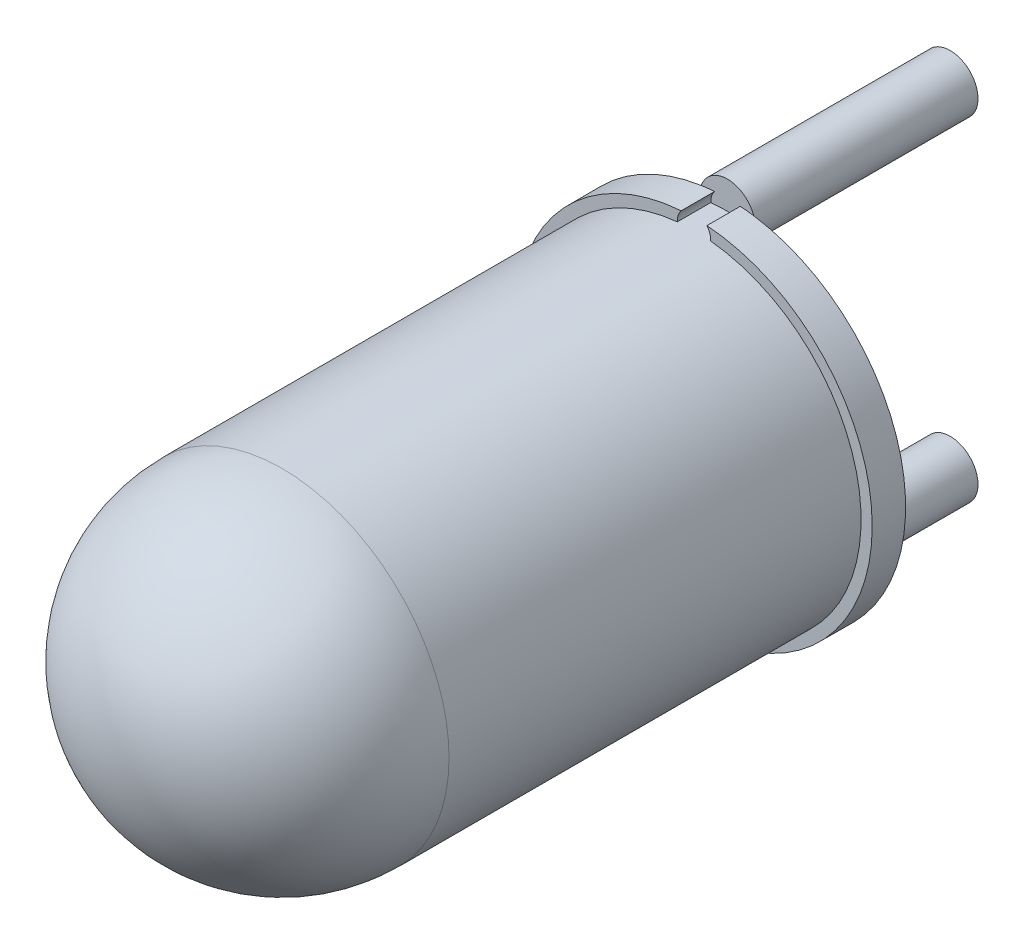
SolidWorks part; units mm, degrees
ref_plane "Front" through (0, 0, 0) normal (0, 0, 1) x (1, 0, 0)
ref_plane "Top" through (0, 0, 0) normal (0, 1, 0) x (1, 0, 0)
ref_plane "Right" through (0, 0, 0) normal (1, 0, 0) x (0, 0, -1)
sketch "Sketch1" plane through (0, 0, 0) normal (0, 0, 1) x (1, 0, 0)
  circle A0 centre (0, 0) radius 1.5
  dimension "D1" = 3
extrude "Base-Extrude" add sketch "Sketch1" along normal blind 4
sketch "Sketch2" plane through (0, 0, 4) normal (0, 0, 1) x (1, 0, 0)
  line L0 (-1.5, 0) -> (1.5, 0)
  line L1 (-1.2281, 0) -> (1.2041, 0) construction
  circle A0 centre (0, 0) radius 1.5 construction
  circle A2 centre (0, 0) radius 1.5
  arc A3 (1.5, 0) -> (-1.5, 0) centre (0, 0) ccw
  dimension "D1" = 0
revolve "Boss-Revolve1" add sketch "Sketch2" angle 360 about L1
sketch "Sketch3" plane through (0, 0, 0) normal (0, 0, -1) x (-1, 0, 0)
  line L0 (0, -0.8512) -> (0, 0.8082) construction
  line L1 (0, 0) -> (-0.5049, 0) construction
  circle A0 centre (0, -1.5) radius 0.25
  circle A1 centre (0, 1.5) radius 0.25
  dimension "D1" = 0.5
  dimension "D2" = 3
extrude "Boss-Extrude1" add sketch "Sketch3" along normal blind 2
sketch "Sketch4" plane through (0, 0, 0) normal (0, 0, -1) x (-1, 0, 0)
  arc A1 (-0.2491, 1.4792) -> (0.2491, 1.4792) centre (0, 1.5) ccw
  arc A2 (-0.2491, 1.4792) -> (0.2491, 1.4792) centre (0, 1.5) ccw
  arc A3 (-0.1154, 1.5958) -> (0.1154, 1.5958) centre (0, 1.5) ccw
  arc A4 (-0.1154, 1.5958) -> (0.1154, 1.5958) centre (0, 1.5) ccw
  arc A12 (-0.2491, 1.4792) -> (-0.2491, -1.4792) centre (0, 0) ccw
  arc A13 (-0.2491, 1.4792) -> (-0.2491, -1.4792) centre (0, 0) ccw
  arc A18 (0.2491, -1.4792) -> (-0.2491, -1.4792) centre (0, -1.5) ccw
  arc A19 (0.2491, -1.4792) -> (-0.2491, -1.4792) centre (0, -1.5) ccw
  arc A20 (0.2491, -1.4792) -> (0.2491, 1.4792) centre (0, 0) ccw
  arc A21 (0.2491, -1.4792) -> (0.2491, 1.4792) centre (0, 0) ccw
  arc A26 (-0.1154, 1.5958) -> (-0.1154, -1.5958) centre (0, 0) ccw
  arc A27 (-0.1154, 1.5958) -> (-0.1154, -1.5958) centre (0, 0) ccw
  arc A28 (0.1154, -1.5958) -> (-0.1154, -1.5958) centre (0, -1.5) ccw
  arc A29 (0.1154, -1.5958) -> (-0.1154, -1.5958) centre (0, -1.5) ccw
  arc A30 (0.1154, -1.5958) -> (0.1154, 1.5958) centre (0, 0) ccw
  arc A31 (0.1154, -1.5958) -> (0.1154, 1.5958) centre (0, 0) ccw
  dimension "D1" = 0
  dimension "D2" = 0.1
extrude "Boss-Extrude2" add sketch "Sketch4" against normal blind 0.3
